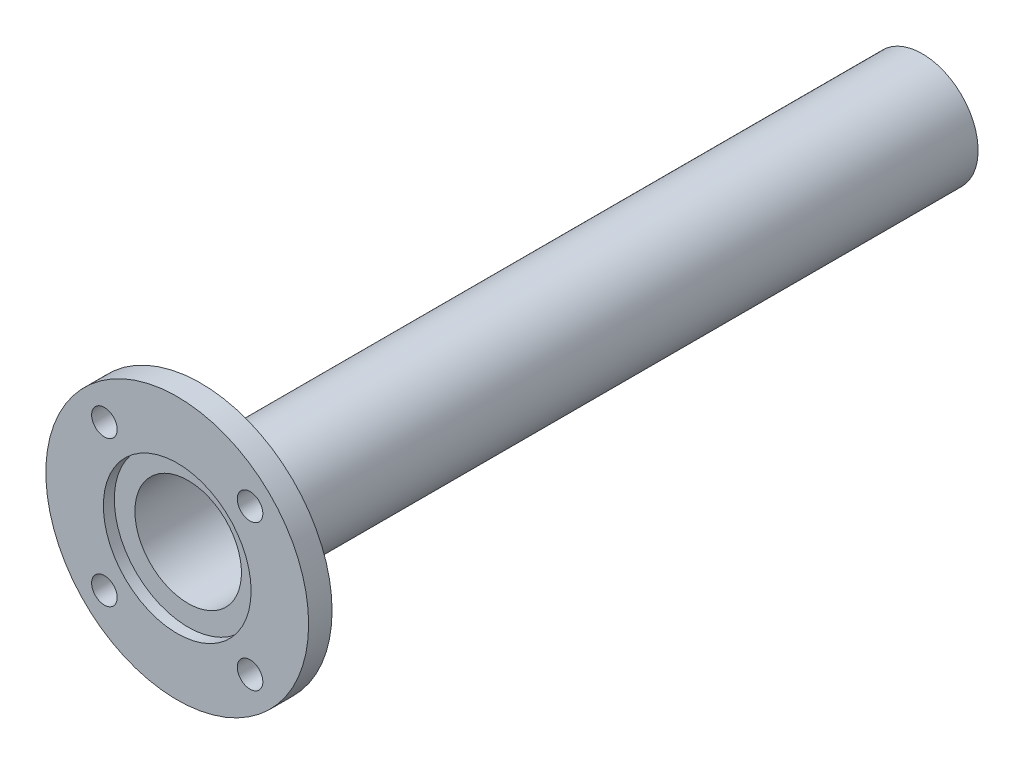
SolidWorks part; units mm, degrees
ref_plane "Front Plane" through (0, 0, 0) normal (0, 0, 1) x (1, 0, 0)
ref_plane "Top Plane" through (0, 0, 0) normal (0, 1, 0) x (1, 0, 0)
ref_plane "Right Plane" through (0, 0, 0) normal (1, 0, 0) x (0, 0, -1)
imported_body "Imported1"
sketch "Sketch1" plane through (0, 0, 0) normal (0, 0, -1) x (-1, 0, 0)
  circle A0 centre (0, 0) radius 37.5 construction
  circle A1 centre (0, 0) radius 37.5
extrude "Extrude-Thin1" add sketch "Sketch1" along normal blind 508 thin
